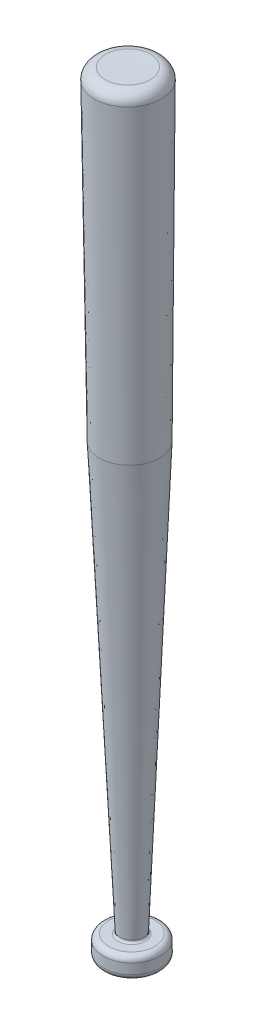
SolidWorks part; units mm, degrees
ref_plane "Front Plane" through (0, 0, 0) normal (0, 0, 1) x (1, 0, 0)
ref_plane "Top Plane" through (0, 0, 0) normal (0, 1, 0) x (1, 0, 0)
ref_plane "Right Plane" through (0, 0, 0) normal (1, 0, 0) x (0, 0, -1)
sketch "Sketch1"
  dimension "D1" = 2.54
revolve "Revolve1" add sketch "Sketch1" angle 360 about L6
